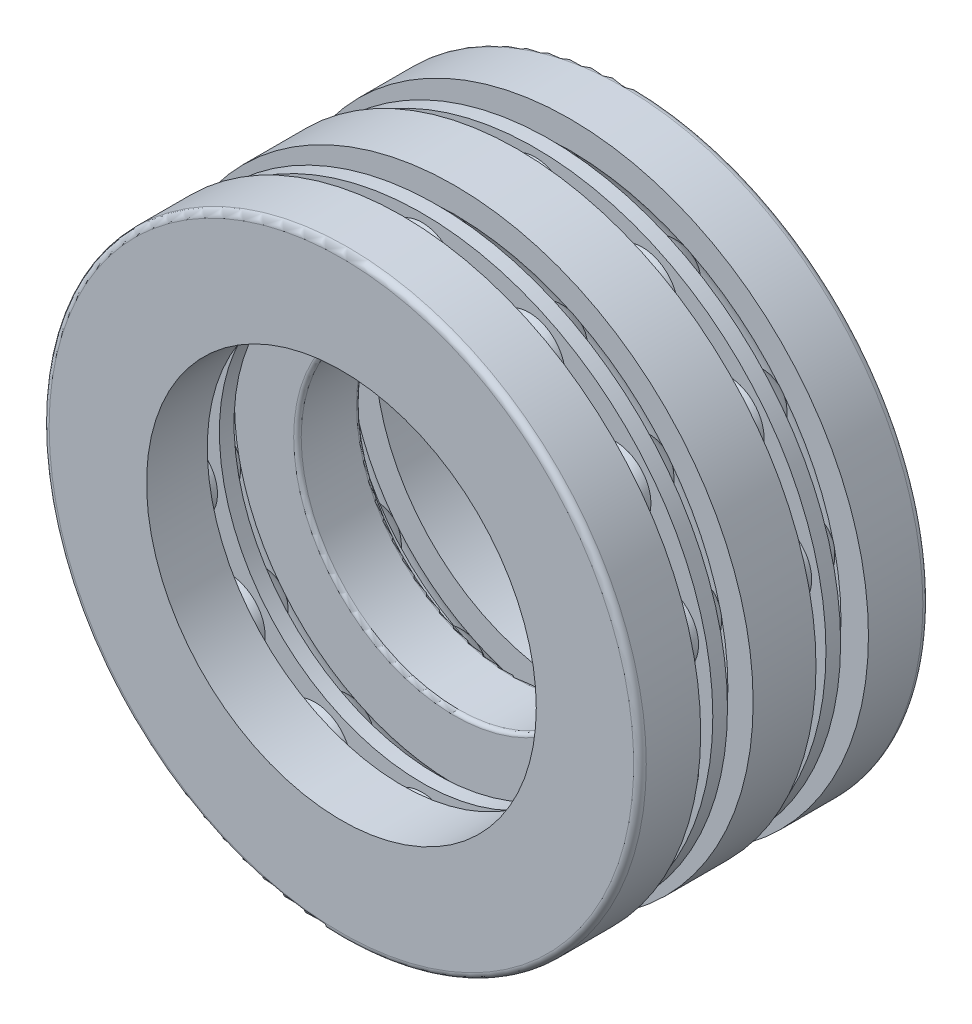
SolidWorks part; units mm, degrees
ref_plane "Front Plane" through (0, 0, 0) normal (0, 0, 1) x (1, 0, 0)
ref_plane "Top Plane" through (0, 0, 0) normal (0, 1, 0) x (1, 0, 0)
ref_plane "Right Plane" through (0, 0, 0) normal (1, 0, 0) x (0, 0, -1)
other "Configuration Table"
sketch "BaseSke" plane through (0, 0, 0) normal (1, 0, 0) x (0, 0, -1)
  line L0 (-14, 0) -> (32, 0) construction
  line L1 (-14, 39.25) -> (32, 39.25) construction
  line L2 (0, 129.5214) -> (0, -86.3012) construction
  line L3 (0, 45.0833) -> (0, 33.4167)
  line L6 (-14, 47.5) -> (-14, 31) construction
  line L8 (14, 47.5) -> (14, 25) construction
  arc A0 (0, 45.0833) -> (0, 33.4167) centre (0, 39.25) ccw
  point P10 (9, 0)
revolve "Ball" add sketch "BaseSke" angle 360 about L3
sketch "InnerRaceSke" plane through (0, 0, 0) normal (1, 0, 0) x (0, 0, -1)
  line L0 (4, 35.0178) -> (4, 25)
  line L1 (4, 47.5) -> (14, 47.5)
  line L2 (4, 47.5) -> (4, 43.4822)
  line L3 (4, 25) -> (14, 25)
  line L4 (14, 47.5) -> (14, 25)
  line L5 (-18.959, 0) -> (19.5136, 0) construction
  line L6 (9, 0) -> (9, 15.6734) construction
  arc A0 (4, 35.0178) -> (4, 43.4822) centre (0, 39.25) ccw
  arc A2 (0, 45.0833) -> (0, 33.4167) centre (0, 39.25) ccw construction
revolve "InnerRace" add sketch "InnerRaceSke" angle 360 about L5
sketch "OuterRaceSke" plane through (0, 0, 0) normal (1, 0, 0) x (0, 0, -1)
  line L0 (-4.3448, 35.3727) -> (-4.3448, 31)
  line L1 (-14, 47.5) -> (-4.3448, 47.5)
  line L2 (-14, 47.5) -> (-14, 31)
  line L3 (-14, 31) -> (-4.3448, 31)
  line L4 (-4.3448, 47.5) -> (-4.3448, 43.1273)
  line L5 (-27.1643, 0) -> (37.3715, 0) construction
  arc A0 (-4.3448, 43.1273) -> (-4.3448, 35.3727) centre (0, 39.25) ccw
  arc A1 (0, 45.0833) -> (0, 33.4167) centre (0, 39.25) ccw construction
revolve "OuterRace" add sketch "OuterRaceSke" angle 360 about L5
fillet "Fillet1" radius 1 1 edges at (47.5, 0, 14)
fillet "Fillet2" radius 0.6 2 edges at (25, 0, -14) (25, 0, -4)
pattern_circular "CirPatternBall" count 14 over 360 about axis through (0, 0, 0) along (0, 0, 1) of "Ball"
sketch "CageSke" plane through (0, 0, 0) normal (1, 0, 0) x (0, 0, -1)
  line L0 (0, 59.1614) -> (0, 0) construction
  line L1 (1.1667, 46.25) -> (-1.1667, 46.25)
  line L2 (1.1667, 46.25) -> (1.1667, 32.25)
  line L3 (1.1667, 32.25) -> (-1.1667, 32.25)
  line L4 (-1.1667, 46.25) -> (-1.1667, 32.25)
  line L5 (-23.077, 0) -> (28.998, 0) construction
  circle A0 centre (0, 39.25) radius 7.0966 construction
  arc A1 (0, 45.0833) -> (0, 33.4167) centre (0, 39.25) ccw construction
revolve "Cage" add sketch "CageSke" angle 360 about L5
sketch "SimplifiedSke" plane through (0, 0, 0) normal (1, 0, 0) x (0, 0, -1)
  line L0 (-32.3536, 0) -> (41.9236, 0) construction
  circle A0 centre (0, 39.25) radius 5.8333
  arc A1 (0, 45.0833) -> (0, 33.4167) centre (0, 39.25) ccw construction
revolve "Simplified" [suppressed] add sketch "SimplifiedSke" angle 360 about L0
ref_plane "Plane" through (0, 0, -9) normal (0, 0, 1) x (1, 0, 0)
other "SurfaceCut"
mirror "MirrorBody" about plane through (0, 0, -9) normal (0, 0, 1)
equation "\"D2@BaseSke\" = \"Thickness2@BaseSke\"/2"
equation "\"D1@BaseSke\" =  ( \"Diameter1@BaseSke\" +\"Bearing_Outside_Diameter@BaseSke\" )  / 4"
equation "\"Ball_diameter@BaseSke\" = \"Thickness2@BaseSke\"  / 2.4"
equation "\"D1@InnerRaceSke\" = \"Ball_diameter@BaseSke\"-0.02"
equation "\"D1@OuterRaceSke\" = \"Ball_diameter@BaseSke\"-0.02"
equation "\"D2@OuterRaceSke\" = \"Thickness2@BaseSke\" / 2.9"
equation "\"D1@CirPatternBall\" =  pi  * \"D1@BaseSke\" * 2 / \"Ball_diameter@BaseSke\"/1.5"
equation "\"D1@CageSke\" = \"Ball_diameter@BaseSke\"/5"
equation "\"D2@CageSke\" = \"Ball_diameter@BaseSke\" * 1.2"
equation "\"D1@Plane\" = \"Bearing_Thickness@BaseSke\"/2"
